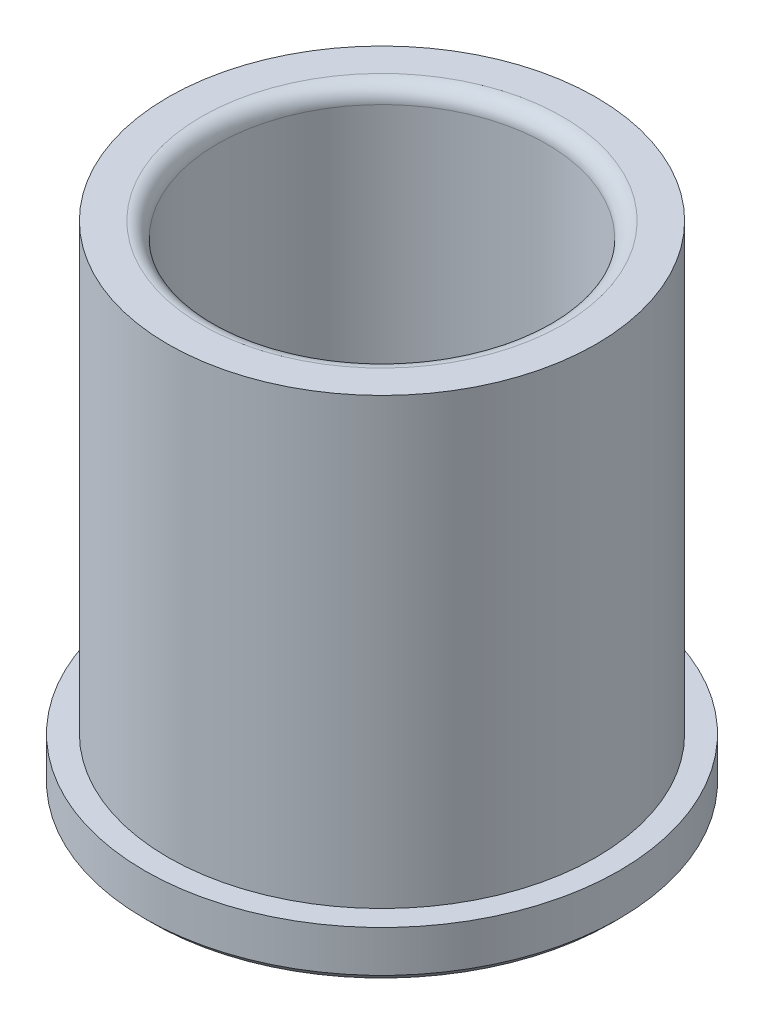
SolidWorks part; units mm, degrees
ref_plane "Front Plane" through (0, 0, 0) normal (0, 0, 1) x (1, 0, 0)
ref_plane "Top Plane" through (0, 0, 0) normal (0, 1, 0) x (1, 0, 0)
ref_plane "Right Plane" through (0, 0, 0) normal (1, 0, 0) x (0, 0, -1)
sketch "Sketch1" plane through (0, 0, 0) normal (0, 0, 1) x (1, 0, 0)
  line L0 (-22.1234, 0) -> (-22.8854, 0.762)
  line L1 (0, -1000) -> (0, 49000) construction
  line L2 (-15.8814, 47.625) -> (-15.8813, 0.762)
  line L3 (-16.6433, 0) -> (-22.1234, 0)
  line L4 (-22.8854, 0.762) -> (-22.8854, 4.7625)
  line L5 (-22.8854, 4.7625) -> (-20.6438, 4.7625)
  line L6 (-20.6438, 47.625) -> (-20.6438, 4.7625)
  line L7 (-20.6438, 47.625) -> (-15.8814, 47.625)
  line L8 (-16.6433, 0) -> (-15.8813, 0.762)
  dimension "OD" = 41.2877
  dimension "ID" = 31.7627
  dimension "H" = 45.7708
  dimension "D2" = 45
  dimension "OVERALL LENGTH" = 47.625
  dimension "D4" = 0.762
  dimension "D5" = 135
  dimension "T" = 4.7625
revolve "Revolve1" add sketch "Sketch1" angle 360 about L1
fillet "Fillet1" radius 1.524 1 edges at (15.8813, 47.625, 0)
